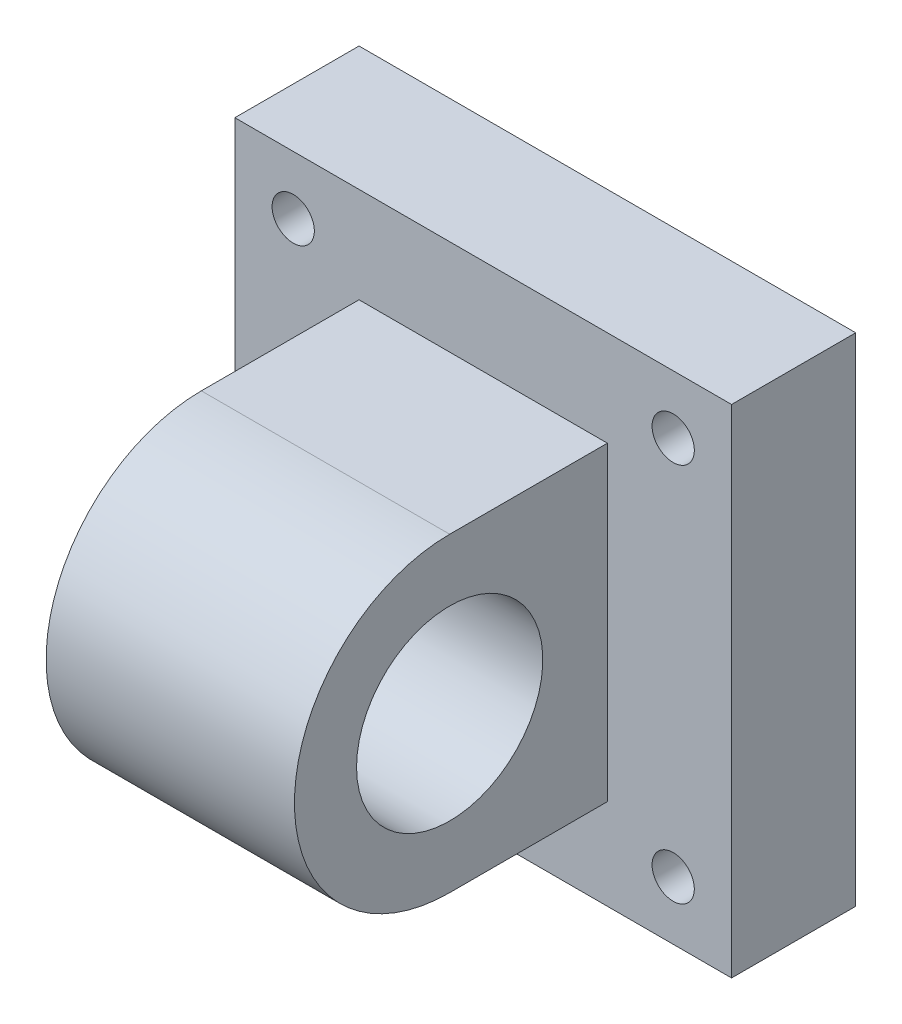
SolidWorks part; units mm, degrees
ref_plane "Piano frontale" through (0, 0, 0) normal (0, 0, 1) x (1, 0, 0)
ref_plane "Piano superiore" through (0, 0, 0) normal (0, 1, 0) x (1, 0, 0)
ref_plane "Piano destro" through (0, 0, 0) normal (1, 0, 0) x (0, 0, -1)
sketch "Sketch1" plane through (0, 0, 0) normal (0, 0, 1) x (1, 0, 0)
  line L1 (-20, -20) -> (20, -20)
  line L2 (-20, -20) -> (-20, 20)
  line L3 (-20, 20) -> (20, 20)
  line L4 (20, -20) -> (20, 20)
  line L5 (-20, -20) -> (20, 20) construction
  line L6 (-20, 20) -> (20, -20) construction
  point P0 (0, 0)
  dimension "D1" = 40
  dimension "D2" = 40
extrude "Boss-Extrude1" add sketch "Sketch1" along normal blind 10
ref_plane "Plane1" through (0, 0, 0) normal (-1, 0, 0) x (0, 0, 1)
sketch "Sketch10" plane through (0, 0, 0) normal (-1, 0, 0) x (0, 0, 1)
  line L0 (10, -12.7) -> (10, 12.3)
  line L3 (22.7, 12.3) -> (10, 12.3)
  line L4 (22.7, -12.7) -> (10, -12.7)
  circle A0 centre (22.7, -0.2) radius 7.5
  circle A1 centre (22.7, -0.2) radius 12.5
  point P4 (10.2, -0.2)
  point P5 (22.7, 12.3)
  point P8 (10.2, -0.2)
  dimension "D1" = 15
  dimension "D3" = 0
  dimension "D2" = 5
extrude "Boss-Extrude2" add sketch "Sketch10" along normal blind 10 and the other way blind 10 contours A1 A0 | A1 L3 L0 | A1 L0 L4
ref_plane "Plane2" through (0, 0, 0) normal (0, -1, 0) x (-1, 0, 0)
sketch "Sketch11" plane through (0, 0, 0) normal (0, 0, -1) x (-1, 0, 0)
  line L0 (20, 20) -> (20, -20) construction
  line L1 (-20, 20) -> (20, 20) construction
  circle A0 centre (15.3, 15.3) radius 1.7
  point P2 (15.3, 17)
  point P3 (17, 15.3)
  point P4 (15.3, 17)
  dimension "D1" = 3.4
  dimension "D2" = 3
  dimension "D3" = 3
extrude "Cut-Extrude1" cut sketch "Sketch11" against normal blind 20
mirror "Mirror1" about plane through (0, 0, 0) normal (0, -1, 0) of "Cut-Extrude1"
mirror "Mirror2" about plane through (0, 0, 0) normal (-1, 0, 0) of "Mirror1", "Cut-Extrude1"
